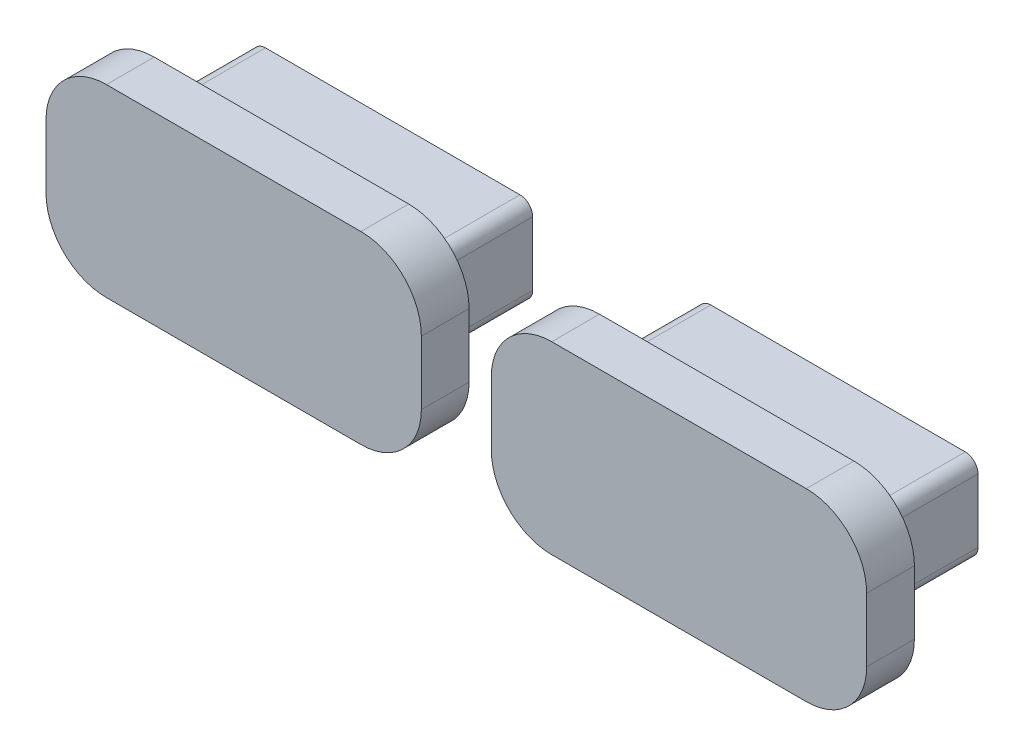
SolidWorks part; units mm, degrees
ref_plane "Front Plane" through (0, 0, 0) normal (0, 0, 1) x (1, 0, 0)
ref_plane "Top Plane" through (0, 0, 0) normal (0, 1, 0) x (1, 0, 0)
ref_plane "Right Plane" through (0, 0, 0) normal (1, 0, 0) x (0, 0, -1)
sketch "Sketch1" plane through (0, 0, 0) normal (0, 0, 1) x (1, 0, 0)
  line L9 (18.908, -55.245) -> (18.908, -52.705)
  line L10 (6.335, -57.658) -> (16.495, -57.658)
  line L11 (3.922, -52.705) -> (3.922, -55.245)
  line L12 (16.495, -50.292) -> (6.335, -50.292)
  line L13 (18.908, -55.245) -> (18.908, -52.705)
  line L14 (6.335, -57.658) -> (16.495, -57.658)
  line L15 (3.922, -52.705) -> (3.922, -55.245)
  line L16 (16.495, -50.292) -> (6.335, -50.292)
  line L22 (21.702, -52.705) -> (21.702, -55.245)
  line L23 (34.275, -50.292) -> (24.115, -50.292)
  line L24 (36.688, -55.245) -> (36.688, -52.705)
  line L25 (24.115, -57.658) -> (34.275, -57.658)
  line L26 (21.702, -52.705) -> (21.702, -55.245)
  line L27 (34.275, -50.292) -> (24.115, -50.292)
  line L28 (36.688, -55.245) -> (36.688, -52.705)
  line L29 (24.115, -57.658) -> (34.275, -57.658)
  arc A8 (18.908, -52.705) -> (16.495, -50.292) centre (16.495, -52.705) ccw
  arc A9 (16.495, -57.658) -> (18.908, -55.245) centre (16.495, -55.245) ccw
  arc A10 (3.922, -55.245) -> (6.335, -57.658) centre (6.335, -55.245) ccw
  arc A11 (6.335, -50.292) -> (3.922, -52.705) centre (6.335, -52.705) ccw
  arc A12 (18.908, -52.705) -> (16.495, -50.292) centre (16.495, -52.705) ccw
  arc A13 (16.495, -57.658) -> (18.908, -55.245) centre (16.495, -55.245) ccw
  arc A14 (3.922, -55.245) -> (6.335, -57.658) centre (6.335, -55.245) ccw
  arc A15 (6.335, -50.292) -> (3.922, -52.705) centre (6.335, -52.705) ccw
  arc A20 (21.702, -55.245) -> (24.115, -57.658) centre (24.115, -55.245) ccw
  arc A21 (24.115, -50.292) -> (21.702, -52.705) centre (24.115, -52.705) ccw
  arc A22 (36.688, -52.705) -> (34.275, -50.292) centre (34.275, -52.705) ccw
  arc A23 (34.275, -57.658) -> (36.688, -55.245) centre (34.275, -55.245) ccw
  arc A24 (21.702, -55.245) -> (24.115, -57.658) centre (24.115, -55.245) ccw
  arc A25 (24.115, -50.292) -> (21.702, -52.705) centre (24.115, -52.705) ccw
  arc A26 (36.688, -52.705) -> (34.275, -50.292) centre (34.275, -52.705) ccw
  arc A27 (34.275, -57.658) -> (36.688, -55.245) centre (34.275, -55.245) ccw
  dimension "D1" = 0.762
  dimension "D2" = 0.762
extrude "Boss-Extrude1" add sketch "Sketch1" against normal up to surface (1.905 mm away)
sketch "Sketch2" plane through (0, 0, -1.905) normal (0, 0, -1) x (-1, 0, 0)
  line L10 (-5.827, -55.245) -> (-5.827, -52.705)
  line L11 (-16.495, -55.753) -> (-6.335, -55.753)
  line L12 (-17.003, -52.705) -> (-17.003, -55.245)
  line L13 (-6.335, -52.197) -> (-16.495, -52.197)
  line L14 (-5.827, -55.245) -> (-5.827, -52.705)
  line L15 (-16.495, -55.753) -> (-6.335, -55.753)
  line L16 (-17.003, -52.705) -> (-17.003, -55.245)
  line L17 (-6.335, -52.197) -> (-16.495, -52.197)
  line L23 (-34.783, -52.705) -> (-34.783, -55.245)
  line L24 (-24.115, -52.197) -> (-34.275, -52.197)
  line L25 (-23.607, -55.245) -> (-23.607, -52.705)
  line L26 (-34.275, -55.753) -> (-24.115, -55.753)
  line L27 (-34.783, -52.705) -> (-34.783, -55.245)
  line L28 (-24.115, -52.197) -> (-34.275, -52.197)
  line L29 (-23.607, -55.245) -> (-23.607, -52.705)
  line L30 (-34.275, -55.753) -> (-24.115, -55.753)
  arc A8 (-6.335, -55.753) -> (-5.827, -55.245) centre (-6.335, -55.245) ccw
  arc A9 (-17.003, -55.245) -> (-16.495, -55.753) centre (-16.495, -55.245) ccw
  arc A10 (-16.495, -52.197) -> (-17.003, -52.705) centre (-16.495, -52.705) ccw
  arc A11 (-5.827, -52.705) -> (-6.335, -52.197) centre (-6.335, -52.705) ccw
  arc A12 (-6.335, -55.753) -> (-5.827, -55.245) centre (-6.335, -55.245) ccw
  arc A13 (-17.003, -55.245) -> (-16.495, -55.753) centre (-16.495, -55.245) ccw
  arc A14 (-16.495, -52.197) -> (-17.003, -52.705) centre (-16.495, -52.705) ccw
  arc A15 (-5.827, -52.705) -> (-6.335, -52.197) centre (-6.335, -52.705) ccw
  arc A20 (-34.275, -52.197) -> (-34.783, -52.705) centre (-34.275, -52.705) ccw
  arc A21 (-23.607, -52.705) -> (-24.115, -52.197) centre (-24.115, -52.705) ccw
  arc A22 (-24.115, -55.753) -> (-23.607, -55.245) centre (-24.115, -55.245) ccw
  arc A23 (-34.783, -55.245) -> (-34.275, -55.753) centre (-34.275, -55.245) ccw
  arc A24 (-34.275, -52.197) -> (-34.783, -52.705) centre (-34.275, -52.705) ccw
  arc A25 (-23.607, -52.705) -> (-24.115, -52.197) centre (-24.115, -52.705) ccw
  arc A26 (-24.115, -55.753) -> (-23.607, -55.245) centre (-24.115, -55.245) ccw
  arc A27 (-34.783, -55.245) -> (-34.275, -55.753) centre (-34.275, -55.245) ccw
  dimension "D1" = 0.762
  dimension "D2" = 0.762
extrude "Boss-Extrude2" add sketch "Sketch2" along normal up to surface (4.445 mm away)
sketch "Sketch3" [suppressed] plane through (0, 0, -6.35) normal (0, 0, -1) x (-1, 0, 0)
  line L1 (-20.7413, -47.2248) -> (-1.9023, -47.2248)
  line L2 (-20.7413, -47.2248) -> (-20.7413, -60.6226)
  line L3 (-20.7413, -60.6226) -> (-1.9023, -60.6226)
  line L4 (-1.9023, -47.2248) -> (-1.9023, -60.6226)
extrude "Cut-Extrude1" [suppressed] cut sketch "Sketch3" against normal up to surface (6.35 mm away)
